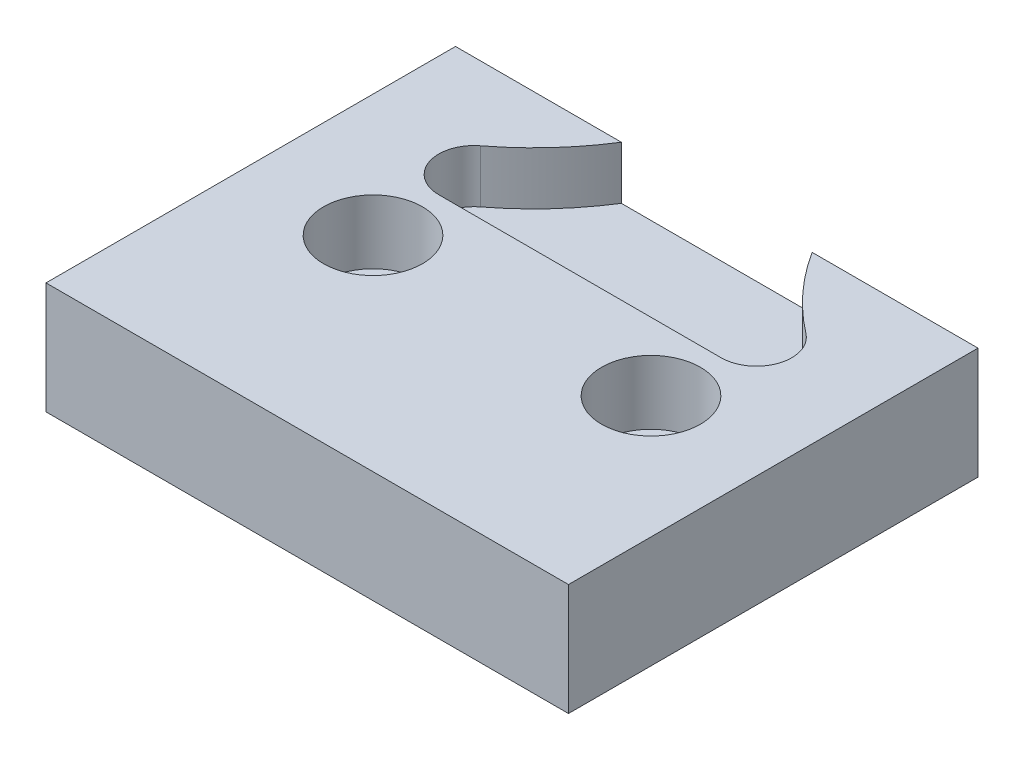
SolidWorks part; units mm, degrees
other "<Soft Jaw A>-<CBORE for 7/16 Socket Head Cap Screw1>"
ref_plane "Front Plane" through (0, 0, 0) normal (0, 0, 1) x (1, 0, 0)
ref_plane "Top Plane" through (0, 0, 0) normal (0, 1, 0) x (1, 0, 0)
ref_plane "Right Plane" through (0, 0, 0) normal (1, 0, 0) x (0, 0, -1)
inserted part "Soft Jaw A"
sketch "Sketch1" plane through (0, 0, 0) normal (0, 1, 0) x (1, 0, 0)
  line L1 (-25.4, 12.2238) -> (25.4001, 12.2238)
  line L2 (-25.4, 12.2238) -> (25.4001, 12.2238)
  arc A5 (25.4001, 12.2238) -> (29.2539, 23.6206) centre (25.4001, 18.5738) ccw
  arc A6 (-29.2538, 23.6206) -> (-25.4, 12.2238) centre (-25.4, 18.5738) ccw
  arc A7 (-29.2538, 23.6206) -> (-9.487, 68.5245) centre (-60.0847, 63.995) ccw
  arc A8 (9.4871, 68.5245) -> (-9.487, 68.5245) centre (0, 69.3738) ccw
  arc A9 (9.4871, 68.5245) -> (29.2539, 23.6206) centre (60.0848, 63.995) ccw
  arc A10 (25.4001, 12.2238) -> (29.2539, 23.6206) centre (25.4001, 18.5738) ccw
  arc A11 (-29.2538, 23.6206) -> (-25.4, 12.2238) centre (-25.4, 18.5738) ccw
  arc A12 (-29.2538, 23.6206) -> (-9.487, 68.5245) centre (-60.0847, 63.995) ccw
  arc A13 (9.4871, 68.5245) -> (-9.487, 68.5245) centre (0, 69.3738) ccw
  arc A14 (9.4871, 68.5245) -> (29.2539, 23.6206) centre (60.0848, 63.995) ccw
  dimension "D1" = 0
extrude "Cut-Extrude1" cut sketch "Sketch1" against normal blind 9.525
